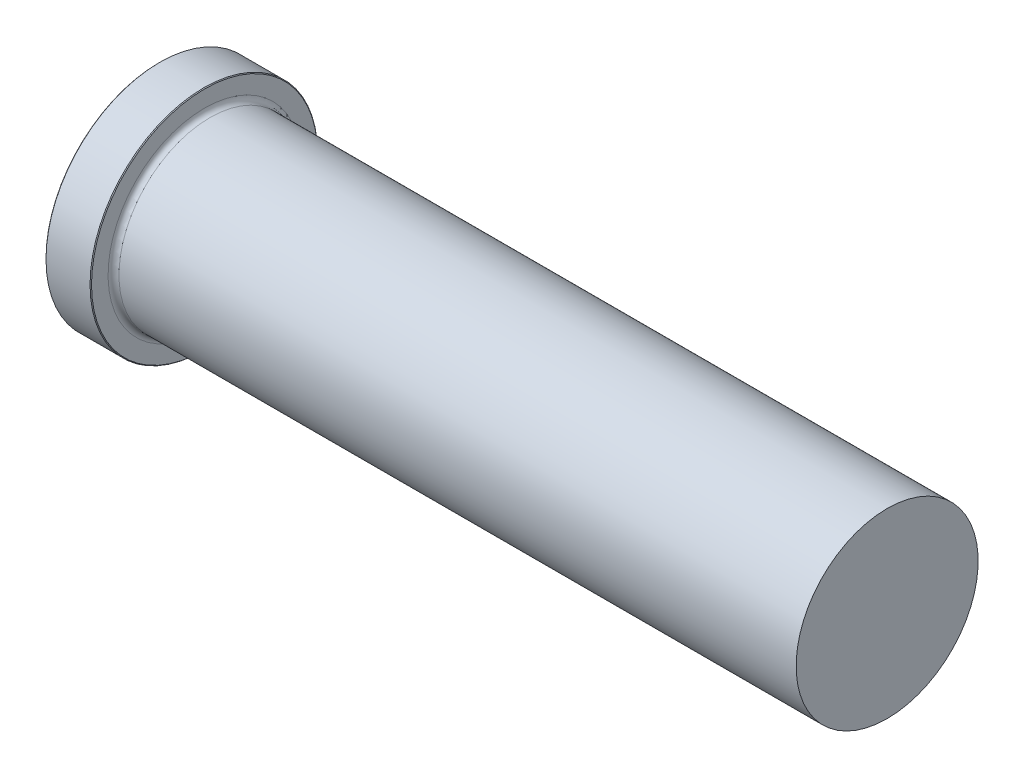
SolidWorks part; units mm, degrees
ref_plane "Front Plane" through (0, 0, 0) normal (0, 0, 1) x (1, 0, 0)
ref_plane "Top Plane" through (0, 0, 0) normal (0, 1, 0) x (1, 0, 0)
ref_plane "Right Plane" through (0, 0, 0) normal (1, 0, 0) x (0, 0, -1)
sketch "Sketch1" plane through (0, 0, 0) normal (0, 0, 1) x (1, 0, 0)
  line L0 (0, 0) -> (0, 15.875)
  line L1 (0, 15.875) -> (6.35, 15.875)
  line L2 (6.35, 15.875) -> (6.35, 13.462)
  line L3 (7.112, 12.7) -> (101.6, 12.7)
  line L4 (101.6, 12.7) -> (101.6, 0)
  line L5 (101.6, 0) -> (0, 0)
  line L6 (101.6, 0) -> (101.6, -12.7) construction
  line L7 (101.6, -12.7) -> (6.35, -12.7) construction
  line L8 (0, 0) -> (0, -15.875) construction
  line L9 (0, -15.875) -> (6.35, -15.875) construction
  line L10 (6.35, -15.875) -> (6.35, -12.7) construction
  arc A0 (6.35, 13.462) -> (7.112, 12.7) centre (7.112, 13.462) ccw
  dimension "D4" = 0.762
  dimension "L" = 101.6
  dimension "D" = 25.4
  dimension "H" = 31.75
  dimension "T" = 6.35
revolve "Revolve1" add sketch "Sketch1" angle 360 about L5
chamfer "Chamfer1" distance 0.1016 angle 45 2 edges at (0, 15.875, 0) (6.35, 15.875, 0)
